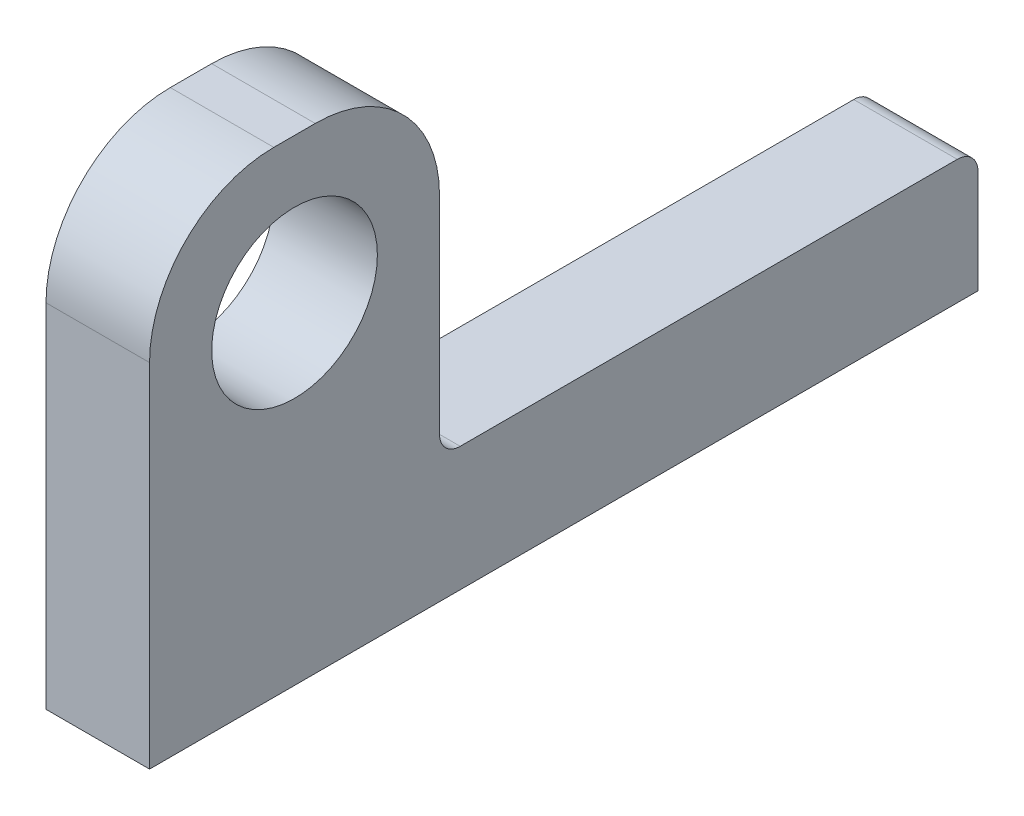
SolidWorks part; units mm, degrees
ref_plane "Front Plane" through (0, 0, 0) normal (0, 0, 1) x (1, 0, 0)
ref_plane "Top Plane" through (0, 0, 0) normal (0, 1, 0) x (1, 0, 0)
ref_plane "Right Plane" through (0, 0, 0) normal (1, 0, 0) x (0, 0, -1)
sketch "Sketch1" plane through (0, 0, 0) normal (1, 0, 0) x (0, 0, -1)
  line L1 (0, 0) -> (40, 0)
  line L2 (0, 0) -> (0, 6)
  line L3 (14, 6) -> (40, 6)
  line L4 (40, 0) -> (40, 6)
  line L6 (0, 6) -> (0, 17)
  line L7 (6, 23) -> (8, 23)
  line L8 (14, 6) -> (14, 17)
  circle A0 centre (7, 16) radius 4
  arc A1 (14, 17) -> (8, 23) centre (8, 17) ccw
  arc A2 (0, 17) -> (6, 23) centre (6, 17) cw
  point P12 (14, 23)
  point P15 (0, 23)
  dimension "D3" = 8
  dimension "D4" = 10
  dimension "D5" = 7
  dimension "D8" = 6
  dimension "D9" = 6
  dimension "D1" = 40
  dimension "D2" = 6
  dimension "D6" = 14
  dimension "D7" = 7
extrude "Boss-Extrude1" add sketch "Sketch1" along normal blind 5
fillet "Fillet1" radius 1 2 edges at (2.5, 6, -40) (2.5, 6, -14)
